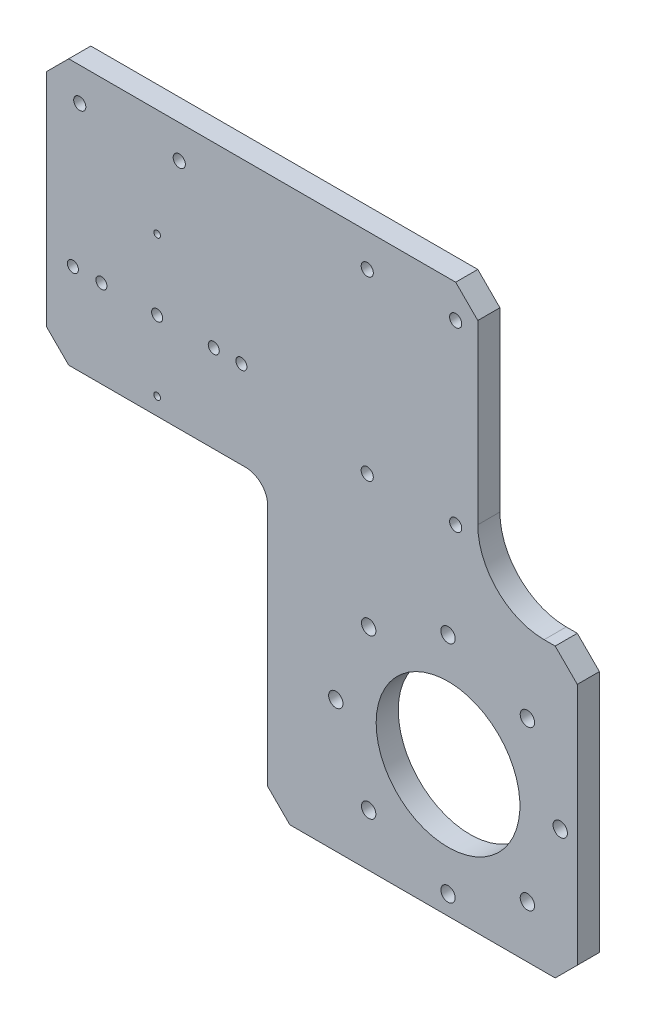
SolidWorks part; units mm, degrees
ref_plane "Plan de face" through (0, 0, 0) normal (0, 0, 1) x (1, 0, 0)
ref_plane "Plan de dessus" through (0, 0, 0) normal (0, 1, 0) x (1, 0, 0)
ref_plane "Plan de droite" through (0, 0, 0) normal (1, 0, 0) x (0, 0, -1)
sketch "Esquisse1" plane through (0, 0, 0) normal (0, 0, 1) x (1, 0, 0)
  line L1 (110, -125) -> (-110, -125)
  line L2 (110, -125) -> (110, 125)
  line L3 (110, 125) -> (-110, 125)
  line L4 (-110, -125) -> (-110, 125)
  line L7 (-110, 125) -> (110, -125) construction
  dimension "D1" = 220
  dimension "D2" = 250
extrude "Boss.-Extru.1" add sketch "Esquisse1" along normal blind 10
hole_wizard "Chambrage pour vis à tête hexagonale M61" positions "Esquisse6" profile "Esquisse7" counterbore size "M6" standard "ISO"
sketch "Esquisse6" plane through (0, 0, 0) normal (0, 0, -1) x (-1, 0, 0)
  line L0 (-110, -125) -> (-110, 125) construction
  line L1 (-110, 125) -> (110, 125) construction
  point P0 (-103, 117.5)
  point P2 (-103, 42.5)
  point P4 (-3, 117.5)
  point P6 (-3, 42.5)
  dimension "D1" = 100
  dimension "D2" = 75
  dimension "D3" = 7
  dimension "D4" = 7.5
sketch "Esquisse7" plane through (103, 117.5, 0) normal (1, 0, 0) x (0, 1, 0)
  line L0 (0, 0) -> (0, 10)
  line L1 (0, 10) -> (3.3, 10)
  line L3 (3.3, 10) -> (3.3, 6.4)
  line L4 (3.3, 6.4) -> (5.5, 6.4)
  line L5 (5.5, 6.4) -> (5.5, 0)
  line L7 (5.5, 0) -> (0, 0)
  line L11 (0, -6.35) -> (0, 107.95) construction
  dimension "Diamètre du perçage jusqu'au prochain" = 6.6
  dimension "Profondeur du perçage jusqu'au prochain" = 10
  dimension "Diamètre du chambrage" = 11
  dimension "Profondeur du chambrage" = 6.4
chamfer "Chanfrein1" [suppressed] distance 2 angle 45
hole_wizard "Trou taraudé M61" positions "Esquisse8" profile "Esquisse9" tap size "M6" standard "ISO"
sketch "Esquisse8" plane through (0, 0, 0) normal (0, 0, -1) x (-1, 0, 0)
  point P0 (21.9, -75.4)
  point P3 (98.1, -75.4)
  dimension "D1" = 76.2
sketch "Esquisse9" plane through (-21.9, -75.4, 0) normal (1, 0, 0) x (0, 1, 0)
  line L0 (0, 0) -> (0, 10)
  line L1 (0, 10) -> (2.5, 10)
  line L2 (2.5, 10) -> (2.5, 0)
  line L5 (2.5, 0) -> (0, 0)
  line L11 (0, -6.35) -> (0, 107.95) construction
  dimension "Diamètre du trou pour taraudage jusqu'au prochain" = 5
  dimension "Profondeur du trou pour taraudage jusqu'au prochain" = 10
hole_wizard "Diamètre du perçage Ø3.0 (3)1" positions "Esquisse10" profile "Esquisse11" hole size "Ø3.0" standard "ISO"
sketch "Esquisse10" plane through (0, 0, 0) normal (0, 0, -1) x (-1, 0, 0)
  line L0 (21.9, -75.4) -> (98.1, -75.4) construction
  line L2 (60, -43.65) -> (60, -75.4) construction
  line L3 (60, -75.4) -> (60, -107.15) construction
  point P0 (60, -107.15)
  point P3 (60, -43.65)
  dimension "D1" = 63.5
sketch "Esquisse11" plane through (-60, -107.15, 0) normal (1, 0, 0) x (0, 1, 0)
  line L0 (0, 0) -> (0, 10)
  line L1 (0, 10) -> (1.5, 10)
  line L2 (1.5, 10) -> (1.5, 0)
  line L5 (1.5, 0) -> (0, 0)
  line L11 (0, -6.35) -> (0, 107.95) construction
  dimension "Diamètre du perçage jusqu'au prochain" = 3
  dimension "Profondeur du perçage jusqu'au prochain" = 10
sketch "Esquisse12" plane through (0, 0, 0) normal (0, 0, -1) x (-1, 0, 0)
  line L1 (114.4221, 120.6703) -> (23.8251, 120.6703)
  line L2 (114.4221, 120.6703) -> (114.4221, 13.3649)
  line L3 (114.4221, 13.3649) -> (23.8251, 13.3649)
  line L4 (23.8251, 120.6703) -> (23.8251, 13.3649)
  line L5 (-115.1689, -135.6546) -> (-31.0098, -135.6546)
  line L6 (-115.1689, -135.6546) -> (-115.1689, 17.648)
  line L7 (-115.1689, 17.648) -> (-31.0098, 17.648)
  line L8 (-31.0098, -135.6546) -> (-31.0098, 17.648)
extrude "Enlèv. mat.-Extru.1" [suppressed] cut sketch "Esquisse12" against normal through all
sketch "Esquisse13" plane through (0, 0, 0) normal (0, 0, -1) x (-1, 0, 0)
  line L0 (-89.8832, 108.3172) -> (-71.3412, 64.45) construction
  line L1 (-71.3412, 64.45) -> (-64.8388, 111.629) construction
  line L2 (-64.8388, 111.629) -> (-40.277, 100.5493) construction
  line L3 (-40.277, 100.5493) -> (-71.3412, 64.45) construction
  circle A0 centre (-71.3412, 64.45) radius 47.625 construction
  point P2 (-40.277, 100.5493)
  point P3 (-25.672, 77.958)
  point P4 (-25.672, 50.942)
  point P5 (-40.277, 28.3507)
  point P6 (-64.8388, 17.271)
  point P7 (-89.8832, 20.5828)
  point P8 (-89.8832, 108.3172)
  point P10 (-64.8388, 111.629)
sketch "Esquisse14" plane through (0, -125, 0) normal (0, -1, 0) x (1, 0, 0)
  line L4 (-110, 0) -> (110, 0)
  line L5 (110, 0) -> (110, 10)
  line L6 (110, 10) -> (-110, 10)
  line L7 (-110, 10) -> (-110, 0)
  line L8 (-110, 0) -> (110, 0)
  line L9 (110, 0) -> (110, 10)
  line L10 (110, 10) -> (-110, 10)
  line L11 (-110, 10) -> (-110, 0)
  dimension "D1" = 0
extrude "Boss.-Extru.2" add sketch "Esquisse14" along normal blind 120
sketch "Esquisse15" plane through (0, 125, 0) normal (0, 1, 0) x (1, 0, 0)
  line L4 (110, 0) -> (-110, 0)
  line L5 (-110, 0) -> (-110, -10)
  line L6 (-110, -10) -> (110, -10)
  line L7 (110, -10) -> (110, 0)
  line L8 (110, 0) -> (-110, 0)
  line L9 (-110, 0) -> (-110, -10)
  line L10 (-110, -10) -> (110, -10)
  line L11 (110, -10) -> (110, 0)
  dimension "D1" = 0
extrude "Enlèv. mat.-Extru.2" cut sketch "Esquisse15" against normal blind 120
sketch "Esquisse16" plane through (0, 0, 0) normal (0, 0, -1) x (-1, 0, 0)
  circle A1 centre (-71.54, -185.54) radius 32.5
  dimension "D1" = 65
extrude "Enlèv. mat.-Extru.3" cut sketch "Esquisse16" against normal blind 120
sketch "Esquisse17" plane through (110, 0, 0) normal (1, 0, 0) x (0, 0, -1)
  line L4 (0, 5) -> (-10, 5)
  line L5 (-10, 5) -> (-10, -245)
  line L6 (-10, -245) -> (0, -245)
  line L7 (0, -245) -> (0, 5)
  line L8 (0, 5) -> (-10, 5)
  line L9 (-10, 5) -> (-10, -245)
  line L10 (-10, -245) -> (0, -245)
  line L11 (0, -245) -> (0, 5)
  dimension "D1" = 0
extrude "Boss.-Extru.3" add sketch "Esquisse17" along normal blind 20
sketch "Esquisse18" plane through (0, 0, 0) normal (0, 0, -1) x (-1, 0, 0)
  line L1 (110, -245) -> (10, -245)
  line L2 (110, -245) -> (110, -115)
  line L3 (110, -115) -> (10, -115)
  line L4 (10, -245) -> (10, -115)
  dimension "D1" = 130
  dimension "D2" = 100
extrude "Enlèv. mat.-Extru.4" cut sketch "Esquisse18" against normal through all
fillet "Congé1" radius 10 1 edges at (-10, -115, 5)
chamfer "Chanfrein2" distance 10 angle 45 5 edges at (-110, -115, 5) (-110, 5, 5) (130, 5, 5) (130, -245, 5) (-10, -245, 5)
sketch "Esquisse19" plane through (0, 0, 10) normal (0, 0, 1) x (1, 0, 0)
  circle A0 centre (35.6543, -221.4257) radius 3.25 construction
  circle A1 centre (71.54, -236.29) radius 3.25 construction
  circle A2 centre (122.29, -185.54) radius 3.25 construction
  circle A3 centre (107.4257, -221.4257) radius 3.25 construction
  circle A4 centre (35.6543, -221.4257) radius 3.25
  circle A5 centre (71.54, -236.29) radius 3.25
  circle A6 centre (122.29, -185.54) radius 3.25
  circle A7 centre (107.4257, -221.4257) radius 3.25
  circle A8 centre (71.54, -134.79) radius 3.25 construction
  circle A9 centre (35.6543, -149.6543) radius 3.25 construction
  circle A10 centre (20.79, -185.54) radius 3.25 construction
  circle A11 centre (71.54, -134.79) radius 3.25
  circle A12 centre (35.6543, -149.6543) radius 3.25
  circle A13 centre (20.79, -185.54) radius 3.25
  circle A14 centre (107.4257, -149.6543) radius 3.25 construction
  circle A15 centre (107.4257, -149.6543) radius 3.25
extrude "Enlèv. mat.-Extru.5" cut sketch "Esquisse19" against normal blind 10
sketch "Esquisse20" plane through (0, 0, 0) normal (0, 0, -1) x (-1, 0, 0)
  line L0 (-130, -235) -> (-130, -5) construction
  line L1 (-120, 5) -> (100, 5) construction
  line L2 (110, -5) -> (110, -105) construction
  circle A0 centre (-115, -10) radius 2.75
  circle A1 centre (-75, -10) radius 2.75
  circle A2 centre (-35, -10) radius 2.75
  circle A3 centre (-35, -90) radius 2.75
  circle A4 centre (-75, -90) radius 2.75
  circle A5 centre (-115, -90) radius 2.75
  circle A6 centre (95, -10) radius 2.75
  circle A7 centre (50, -10) radius 2.75
  dimension "D1" = 5.5
  dimension "D2" = 15
  dimension "D3" = 15
  dimension "D4" = 40
  dimension "D5" = 40
  dimension "D6" = 80
  dimension "D7" = 15
  dimension "D8" = 60
extrude "Enlèv. mat.-Extru.6" cut sketch "Esquisse20" against normal blind 10
hole_wizard "Trou taraudé M6x1.01" positions "Esquisse21" profile "Esquisse22" tap size "M6x1.0" standard "Ansi Metric"
sketch "Esquisse21" plane through (0, 0, 0) normal (0, 0, -1) x (-1, 0, 0)
  point P0 (85.2, -75.4)
  point P3 (60, -75.4)
  point P6 (34.4, -75.4)
sketch "Esquisse22" plane through (-85.2, -75.4, 0) normal (1, 0, 0) x (0, 1, 0)
  line L0 (0, 0) -> (0, 10)
  line L1 (0, 10) -> (2.5, 10)
  line L2 (2.5, 10) -> (2.5, 0)
  line L5 (2.5, 0) -> (0, 0)
  line L11 (0, -6.35) -> (0, 107.95) construction
  dimension "Diamètre du trou pour taraudage jusqu'au prochain" = 5
  dimension "Profondeur du trou pour taraudage jusqu'au prochain" = 10
sketch "Esquisse23" plane through (0, 0, 0) normal (0, 0, -1) x (-1, 0, 0)
  line L0 (-130, -235) -> (-130, -5) construction
  line L1 (-130, -115) -> (-85, -115)
  line L2 (-130, -115) -> (-130, 5)
  line L3 (-130, 5) -> (-85, 5)
  line L4 (-85, -115) -> (-85, 5)
  line L5 (-120, 5) -> (100, 5) construction
  dimension "D1" = 45
  dimension "D2" = 120
extrude "Enlèv. mat.-Extru.7" cut sketch "Esquisse23" against normal through all
fillet "Congé2" radius 30 1 edges at (85, -115, 5)
chamfer "Chanfrein3" distance 10 angle 45 2 edges at (130, -115, 5) (85, 5, 5)
